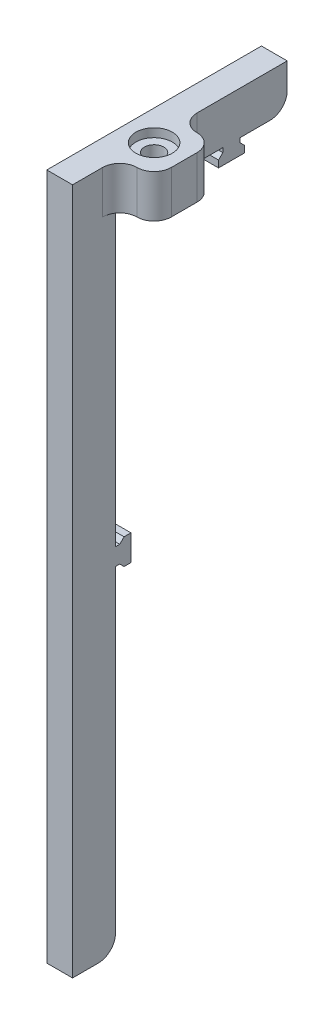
SolidWorks part; units mm, degrees
ref_plane "Plano frontal" through (0, 0, 0) normal (1, 0, 0) x (0, 1, 0)
ref_plane "Plano superior" through (0, 0, 0) normal (0, 0, 1) x (0, 1, 0)
ref_plane "Plano direito" through (0, 0, 0) normal (0, 1, 0) x (-1, 0, 0)
sketch "Esboço1" plane through (0, 0, 0) normal (1, 0, 0) x (0, 1, 0)
  line L0 (0, 0) -> (0, -50)
  line L1 (0, 0) -> (-160, 0)
  line L2 (-160, 0) -> (-160, -10)
  line L3 (-160, -10) -> (-10, -10)
  line L5 (-10, -50) -> (0, -50)
  line L6 (-10, -50) -> (-10, -10)
  point P3 (-6, -48.6735)
  point P8 (-10.7405, -10)
  dimension "D1" = 160
  dimension "D2" = 50
  dimension "D3" = 10
  dimension "D4" = 10
extrude "Ressalto-extrusão1" add sketch "Esboço1" along normal blind 6
sketch "Esboço2" plane through (0, 0, 0) normal (0, 1, 0) x (-1, 0, 0)
  line L0 (0, -10) -> (0, -50) construction
  line L1 (-6, 0) -> (0, 0) construction
  circle A0 centre (-7, -18) radius 4.25
  point P2 (-8.54, -20.0548)
  point P3 (-8.0125, -15.0438)
  point P4 (-7.3181, -14.1207)
  point P5 (-6.9049, -16.7581)
  point P6 (-7.894, -17.6152)
  point P7 (0, 0)
  dimension "D1" = 8.5
  dimension "D2" = 7
  dimension "D3" = 18
extrude "Corte-extrusão1" cut sketch "Esboço2" against normal blind 16
sketch "Esboço4" plane through (0, 0, 0) normal (0, 1, 0) x (-1, 0, 0)
  line L0 (0, -50) -> (0, 0) construction
  line L1 (0, -25) -> (-14, -25)
  line L2 (0, -25) -> (0, -11)
  line L3 (0, -11) -> (-14, -11)
  line L4 (-14, -25) -> (-14, -11)
  line L5 (0, -25) -> (-14, -11) construction
  line L6 (0, -11) -> (-14, -25) construction
  circle A0 centre (-7, -18) radius 4.25
  arc A1 (-6, -22.1307) -> (-6, -13.8693) centre (-7, -18) ccw construction
  point P9 (0, -10.8898)
extrude "Ressalto-extrusão2" add sketch "Esboço4" against normal up to vertex
ref_plane "Plano1" through (0, -2, 0) normal (0, 1, 0) x (1, 0, 0)
sketch "Esboço5" plane through (0, -2, 0) normal (0, 1, 0) x (-1, 0, 0)
  circle A1 centre (-7, -18) radius 2.25
  circle A2 centre (-7, -18) radius 4.25 construction
  circle A3 centre (-7, -18) radius 4.25
  dimension "D1" = 4.5
extrude "Ressalto-extrusão3" add sketch "Esboço5" against normal blind 4
chamfer "Chanfro1" distance 2 angle 45 1 edges at (7, -6, -13.75)
fillet "Filete1" radius 1 1 edges at (7, -10, -13.75)
fillet "Filete2" radius 4 4 edges at (6, -5, -11) (14, -5, -11) (14, -5, -25) (6, -5, -25)
sketch "Esboço6" plane through (0, 0, -10) normal (0, 0, -1) x (1, 0, 0)
  line L1 (6, 160) -> (14, 160)
  line L2 (6, 160) -> (6, 10)
  line L3 (6, 10) -> (14, 10)
  line L4 (14, 160) -> (14, 10)
extrude "Corte-extrusão2" cut sketch "Esboço6" against normal up to vertex
fillet "Filete3" radius 4 2 edges at (3, -10, -50) (3, -160, -10)
sketch "Esboço7" plane through (0, 0, 0) normal (-1, 0, 0) x (0, -1, 0)
  line L0 (10, -39) -> (11, -39)
  line L1 (10, -10) -> (10, -46) construction
  line L2 (11, -39) -> (12, -40)
  line L3 (12, -40) -> (13.6, -40)
  line L4 (13.6, -40) -> (13.6, -34)
  line L5 (13.6, -34) -> (12, -34)
  line L6 (12, -34) -> (11, -35)
  line L7 (11, -35) -> (10, -35)
  line L8 (10, -35) -> (10, -39)
  line L9 (10, -37) -> (13.6, -37) construction
  line L10 (6, -50) -> (0, -50) construction
  line L11 (82, -10) -> (82, -11)
  line L12 (156, -10) -> (10, -10) construction
  line L13 (82, -11) -> (83, -12)
  line L14 (83, -12) -> (83, -13.6)
  line L15 (83, -13.6) -> (77, -13.6)
  line L16 (77, -13.6) -> (77, -12)
  line L17 (77, -12) -> (78, -11)
  line L18 (78, -11) -> (78, -10)
  line L19 (78, -10) -> (82, -10)
  line L20 (80, -10) -> (80, -13.6) construction
  line L21 (160, 0) -> (160, -6) construction
  point P26 (0, 0)
  point P27 (87.2801, -15.4067)
  point P28 (80, -13.6)
  point P29 (0, 0)
  point P30 (0, 0)
  point P31 (0, 0)
  point P32 (68.3672, -10)
  dimension "D1" = 1
  dimension "D2" = 4
  dimension "D3" = 1
  dimension "D4" = 1
  dimension "D5" = 1.6
  dimension "D6" = 10
  dimension "D7" = 80
extrude "Ressalto-extrusão4" add sketch "Esboço7" against normal up to vertex
